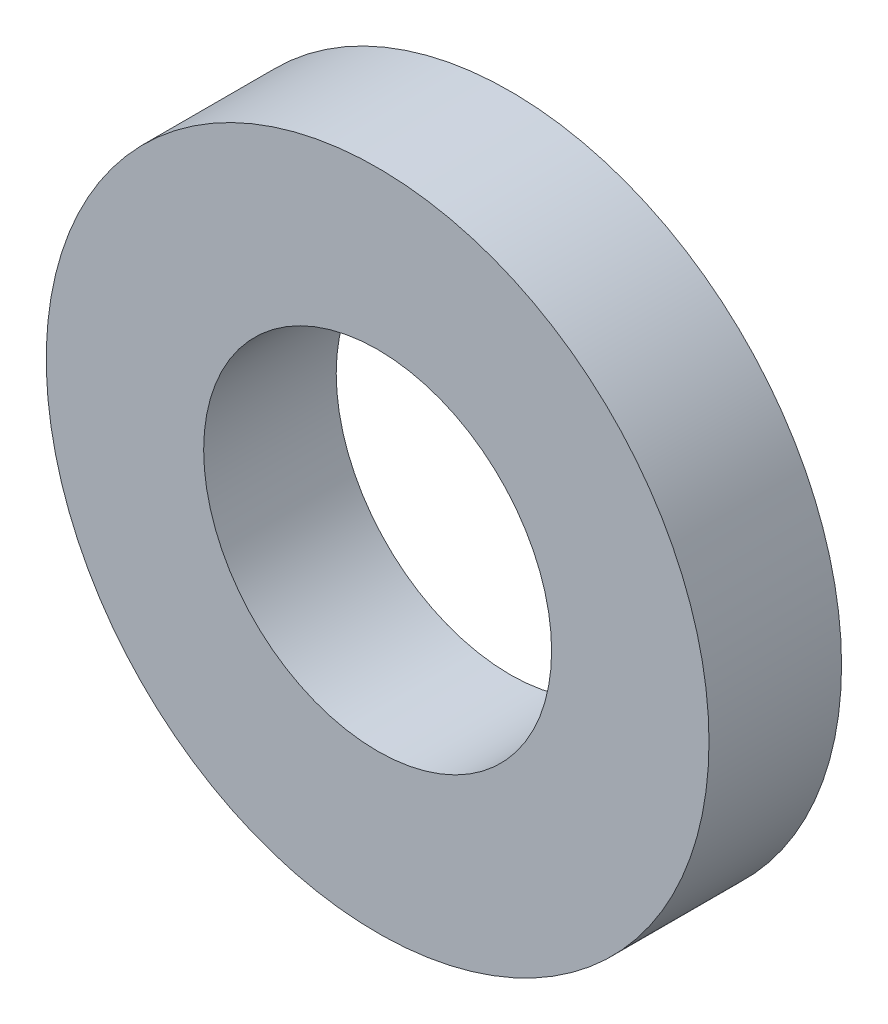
SolidWorks part; units mm, degrees
ref_plane "Plan de face" through (0, 0, 0) normal (0, 0, 1) x (1, 0, 0)
ref_plane "Plan de dessus" through (0, 0, 0) normal (0, 1, 0) x (1, 0, 0)
ref_plane "Plan de droite" through (0, 0, 0) normal (1, 0, 0) x (0, 0, -1)
sketch "Esquisse1" plane through (0, 0, 0) normal (0, 0, 1) x (1, 0, 0)
  circle A0 centre (350.9412, 0) radius 21
  circle A1 centre (350.9412, 0) radius 40
  dimension "D1" = 80
  dimension "D2" = 42
extrude "Boss.-Extru.1" add sketch "Esquisse1" along normal blind 16
